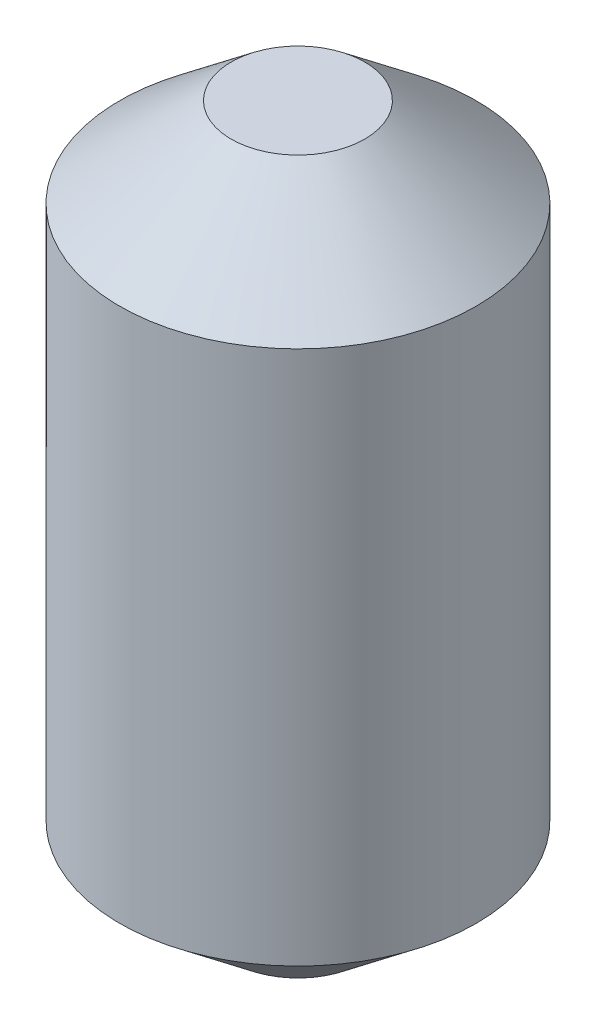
SolidWorks part; units mm, degrees
ref_plane "Front Plane" through (0, 0, 0) normal (0, 0, 1) x (1, 0, 0)
ref_plane "Top Plane" through (0, 0, 0) normal (0, 1, 0) x (1, 0, 0)
ref_plane "Right Plane" through (0, 0, 0) normal (1, 0, 0) x (0, 0, -1)
sketch "Sketch1" plane through (0, 0, 0) normal (0, 0, 1) x (1, 0, 0)
  line L0 (0, -16000) -> (0, 16000) construction
  line L1 (0, -16000) -> (3000, -16000)
  line L2 (3000, -16000) -> (8000, -12000)
  line L3 (8000, -12000) -> (8000, 12000)
  line L4 (8000, 12000) -> (3000, 16000)
  line L5 (3000, 16000) -> (0, 16000)
  line L6 (0, 16000) -> (0, -16000)
revolve "Revolve1" add sketch "Sketch1" angle 360 about L0
sketch "Sketch2" plane through (0, 0, 0) normal (0, 1, 0) x (1, 0, 0)
  line L1 (8000, -3000) -> (36000, -3000)
  line L2 (8000, -3000) -> (8000, 3000)
  line L3 (8000, 3000) -> (36000, 3000)
  line L4 (36000, -3000) -> (36000, 3000)
  line L5 (-36000, -3000) -> (-8000, -3000)
  line L6 (-36000, -3000) -> (-36000, 3000)
  line L7 (-36000, 3000) -> (-8000, 3000)
  line L8 (-8000, -3000) -> (-8000, 3000)
  line L9 (-3000, 8000) -> (3000, 8000)
  line L10 (-3000, 8000) -> (-3000, 36000)
  line L11 (-3000, 36000) -> (3000, 36000)
  line L12 (3000, 8000) -> (3000, 36000)
  line L13 (-3000, -36000) -> (3000, -36000)
  line L14 (-3000, -36000) -> (-3000, -8000)
  line L15 (-3000, -8000) -> (3000, -8000)
  line L16 (3000, -36000) -> (3000, -8000)
